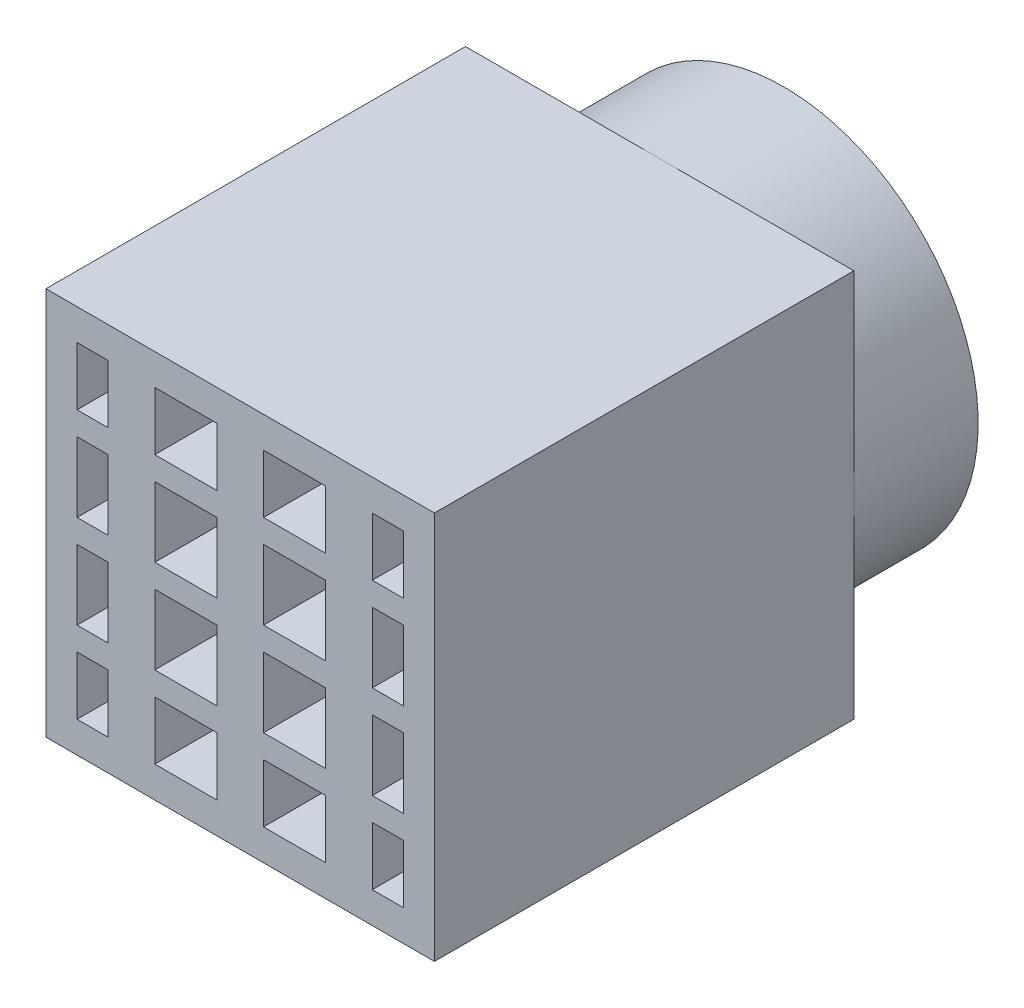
SolidWorks part; units mm, degrees
ref_plane "前视基准面" through (0, 0, 0) normal (0, 0, 1) x (1, 0, 0)
ref_plane "上视基准面" through (0, 0, 0) normal (0, 1, 0) x (1, 0, 0)
ref_plane "右视基准面" through (0, 0, 0) normal (1, 0, 0) x (0, 0, -1)
sketch "草图8" plane through (0, 0, 0) normal (0, 0, 1) x (1, 0, 0)
  line L0 (0, 7.8741) -> (0, -9.2542) construction
  line L1 (-12.5, -12.5) -> (12.5, -12.5)
  line L2 (-12.5, -12.5) -> (-12.5, 12.5)
  line L3 (-12.5, 12.5) -> (12.5, 12.5)
  line L4 (12.5, -12.5) -> (12.5, 12.5)
  line L5 (-12.5, -12.5) -> (12.5, 12.5) construction
  line L6 (-12.5, 12.5) -> (12.5, -12.5) construction
  line L7 (-16.0619, 0) -> (15.5648, 0) construction
  line L8 (-3.5, 7.8741) -> (-3.5, -9.2542) construction
  line L9 (-9.5, 7.8741) -> (-9.5, -9.2542) construction
  line L10 (5.5, 10.5) -> (1.5, 10.5)
  line L15 (-5.5, -10.5) -> (-1.5, -10.5)
  line L20 (-5.5, -10.5) -> (-5.5, 10.5)
  line L21 (-5.5, 10.5) -> (-1.5, 10.5)
  line L26 (-1.5, -10.5) -> (-1.5, 10.5)
  line L27 (-5.5, -10.5) -> (-1.5, 10.5) construction
  line L28 (-5.5, 10.5) -> (-1.5, -10.5) construction
  line L29 (-10.5, -10.5) -> (-8.5, -10.5)
  line L30 (-10.5, -10.5) -> (-10.5, 10.5)
  line L31 (-10.5, 10.5) -> (-8.5, 10.5)
  line L32 (-8.5, -10.5) -> (-8.5, 10.5)
  line L33 (-10.5, -10.5) -> (-8.5, 10.5) construction
  line L34 (-10.5, 10.5) -> (-8.5, -10.5) construction
  line L35 (1.5, -10.5) -> (1.5, 10.5)
  line L36 (5.5, -10.5) -> (1.5, -10.5)
  line L37 (5.5, -10.5) -> (5.5, 10.5)
  line L38 (10.5, 10.5) -> (8.5, 10.5)
  line L39 (8.5, -10.5) -> (8.5, 10.5)
  line L40 (10.5, -10.5) -> (8.5, -10.5)
  line L41 (10.5, -10.5) -> (10.5, 10.5)
  point P0 (0, 0)
  point P14 (-7, 0)
  point P15 (-3.5, 0)
  point P17 (-3, 0)
  point P21 (-9.5, 0)
  point P22 (-9, 0)
  dimension "D1" = 3.5
  dimension "D2" = 6
extrude "凸台-拉伸7" add sketch "草图8" along normal blind 25
sketch "草图9" plane through (0, 0, 0) normal (0, 0, -1) x (-1, 0, 0)
  line L1 (-12.5, -12.5) -> (12.5, -12.5)
  line L2 (-12.5, -12.5) -> (-12.5, 12.5)
  line L3 (-12.5, 12.5) -> (12.5, 12.5)
  line L4 (12.5, -12.5) -> (12.5, 12.5)
  line L5 (-12.5, -12.5) -> (12.5, 12.5) construction
  line L6 (-12.5, 12.5) -> (12.5, -12.5) construction
  point P0 (0, 0)
extrude "凸台-拉伸8" add sketch "草图9" along normal blind 2
sketch "草图14" plane through (0, 0, 25) normal (0, 0, 1) x (1, 0, 0)
  line L0 (-16.6961, 0) -> (20.7273, 0) construction
  line L1 (-12.5, 12.5) -> (-12.5, -12.5) construction
  line L2 (12.5, -0.75) -> (-12.5, -0.75)
  line L3 (12.5, -0.75) -> (12.5, 0.75)
  line L4 (12.5, 0.75) -> (-12.5, 0.75)
  line L5 (-12.5, -0.75) -> (-12.5, 0.75)
  line L6 (12.5, -0.75) -> (-12.5, 0.75) construction
  line L7 (12.5, 0.75) -> (-12.5, -0.75) construction
  line L12 (12.5, 5.25) -> (-12.5, 5.25)
  line L13 (12.5, 5.25) -> (12.5, 6.75)
  line L14 (12.5, 6.75) -> (-12.5, 6.75)
  line L15 (-12.5, 5.25) -> (-12.5, 6.75)
  line L16 (12.5, 5.25) -> (-12.5, 6.75) construction
  line L17 (12.5, 6.75) -> (-12.5, 5.25) construction
  line L18 (12.5, -6.75) -> (-12.5, -5.25) construction
  line L19 (12.5, -5.25) -> (-12.5, -6.75) construction
  line L20 (-12.5, -5.25) -> (-12.5, -6.75)
  line L21 (12.5, -6.75) -> (-12.5, -6.75)
  line L22 (12.5, -5.25) -> (12.5, -6.75)
  line L23 (12.5, -5.25) -> (-12.5, -5.25)
  point P3 (0, 0)
  point P11 (0, 6)
  point P19 (0, -6)
  dimension "D1" = 2
extrude "凸台-拉伸11" add sketch "草图14" against normal blind 25
sketch "草图16" plane through (0, 0, -2) normal (0, 0, -1) x (-1, 0, 0)
  circle A0 centre (0, 0) radius 12.5
  circle A1 centre (0, 0) radius 10
extrude "凸台-拉伸14" add sketch "草图16" along normal blind 6
sketch "草图17" plane through (0, 0, -8) normal (0, 0, -1) x (-1, 0, 0)
  circle A0 centre (0, 0) radius 12.5
extrude "凸台-拉伸15" add sketch "草图17" along normal blind 2
